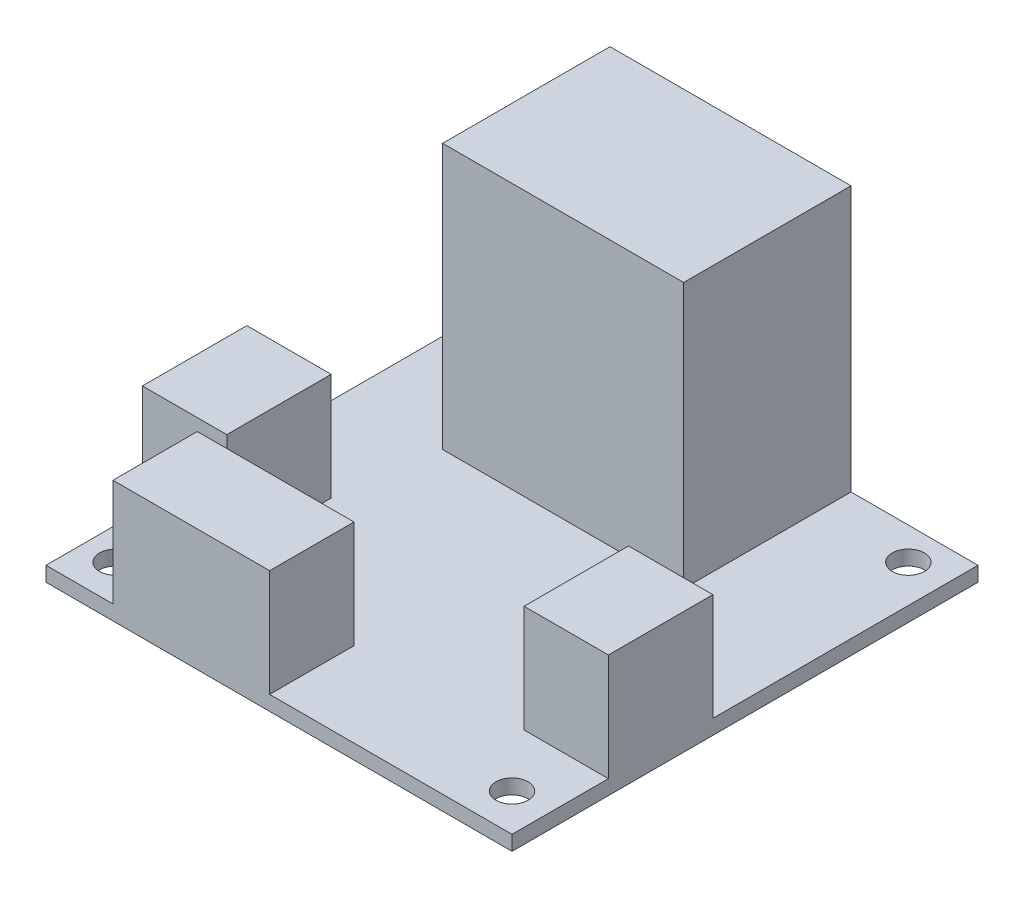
SolidWorks part; units mm, degrees
ref_plane "Front Plane" through (0, 0, 0) normal (0, 0, 1) x (1, 0, 0)
ref_plane "Top Plane" through (0, 0, 0) normal (0, 1, 0) x (1, 0, 0)
ref_plane "Right Plane" through (0, 0, 0) normal (1, 0, 0) x (0, 0, -1)
sketch "Sketch1" plane through (0, 0, 0) normal (0, 1, 0) x (1, 0, 0)
  line L1 (0, 0) -> (44.196, 0)
  line L2 (0, 0) -> (0, 44.196)
  line L3 (0, 44.196) -> (44.196, 44.196)
  line L4 (44.196, 0) -> (44.196, 44.196)
  circle A0 centre (3.048, 41.148) radius 1.524
  circle A1 centre (40.64, 41.148) radius 1.524
  circle A2 centre (40.64, 3.556) radius 1.524
  circle A3 centre (3.048, 3.556) radius 1.524
  dimension "D3" = 3.048
  dimension "D1" = 44.196
  dimension "D2" = 44.196
  dimension "D4" = 3.048
  dimension "D5" = 3.048
  dimension "D6" = 2
  dimension "D7" = 2
extrude "Boss-Extrude1" add sketch "Sketch1" along normal blind 1.397
sketch "Sketch2" plane through (0, 1.397, 0) normal (0, 1, 0) x (1, 0, 0)
  line L0 (44.196, 44.196) -> (0, 44.196) construction
  line L1 (9.2953, 44.196) -> (32.1553, 44.196)
  line L2 (9.2953, 44.196) -> (9.2953, 28.321)
  line L3 (9.2953, 28.321) -> (32.1553, 28.321)
  line L4 (32.1553, 44.196) -> (32.1553, 28.321)
  dimension "D1" = 22.86
  dimension "D2" = 15.875
extrude "Boss-Extrude2" add sketch "Sketch2" along normal blind 25.146
sketch "Sketch3" plane through (0, 1.397, 0) normal (0, 1, 0) x (1, 0, 0)
  line L0 (0, 44.196) -> (0, 0) construction
  line L1 (0, 19.05) -> (8.001, 19.05)
  line L2 (0, 19.05) -> (0, 9.144)
  line L3 (0, 9.144) -> (8.001, 9.144)
  line L4 (8.001, 19.05) -> (8.001, 9.144)
  line L5 (0, 0) -> (44.196, 0) construction
  line L6 (6.35, 0) -> (21.209, 0)
  line L7 (6.35, 0) -> (6.35, 8.001)
  line L8 (6.35, 8.001) -> (21.209, 8.001)
  line L9 (21.209, 0) -> (21.209, 8.001)
  line L10 (44.196, 0) -> (44.196, 44.196) construction
  line L11 (44.196, 9.144) -> (36.195, 9.144)
  line L12 (44.196, 9.144) -> (44.196, 19.05)
  line L13 (44.196, 19.05) -> (36.195, 19.05)
  line L14 (36.195, 9.144) -> (36.195, 19.05)
  dimension "D1" = 9.906
  dimension "D2" = 9.906
  dimension "D3" = 9.144
  dimension "D4" = 9.144
  dimension "D5" = 6.35
  dimension "D6" = 14.859
  dimension "D7" = 8.001
  dimension "D8" = 8.001
  dimension "D9" = 8.001
extrude "Boss-Extrude3" add sketch "Sketch3" along normal blind 10.16
